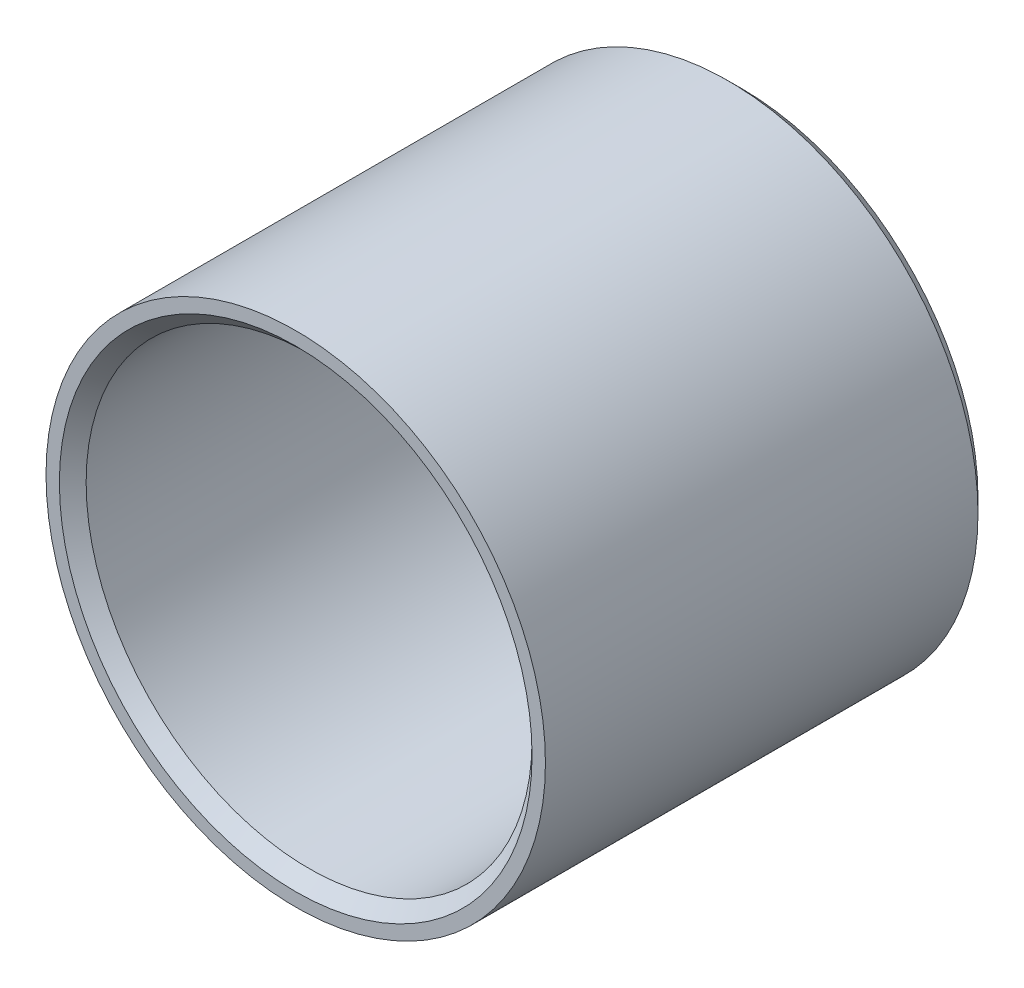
SolidWorks part; units mm, degrees
ref_plane "Plan1" through (0, 0, 0) normal (0, 0, 1) x (1, 0, 0)
ref_plane "Plan2" through (0, 0, 0) normal (0, 1, 0) x (1, 0, 0)
ref_plane "Plan3" through (0, 0, 0) normal (1, 0, 0) x (0, 0, -1)
sketch "Esquisse1" plane through (0, 0, 0) normal (0, 0, 1) x (1, 0, 0)
  circle A0 centre (0, 0) radius 12.5
  circle A1 centre (0, 0) radius 14
  dimension "D1" = 25
  dimension "D2" = 28
extrude "Base-Extrusion" add sketch "Esquisse1" along normal blind 25
chamfer "Chanfrein1" distance 0.75 angle 45
